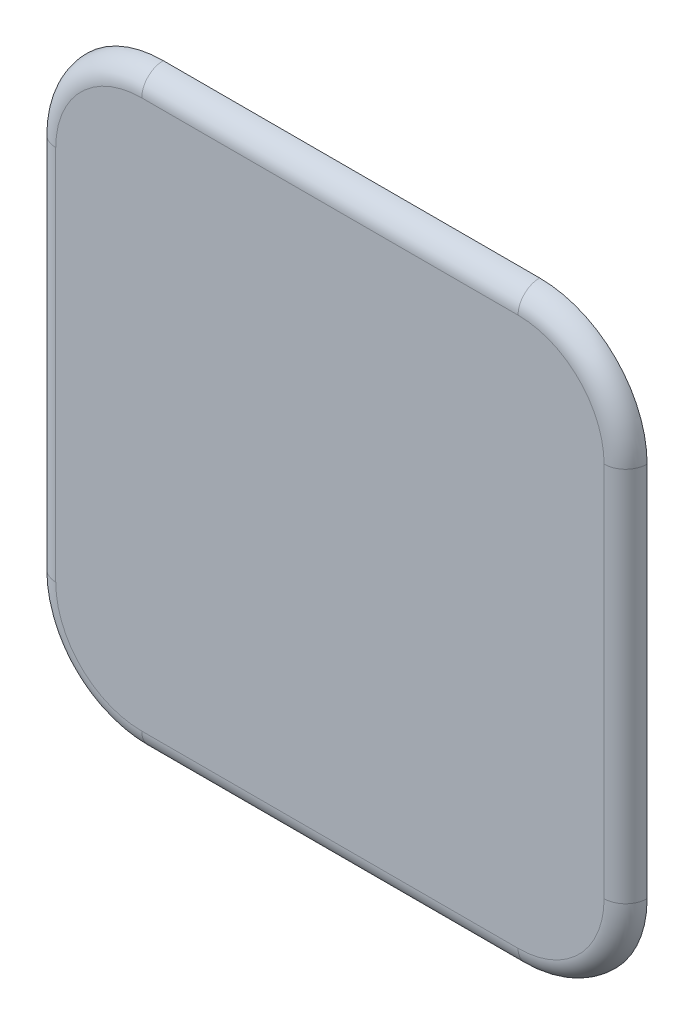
SolidWorks part; units mm, degrees
ref_plane "Front Plane" through (0, 0, 0) normal (0, 0, 1) x (1, 0, 0)
ref_plane "Top Plane" through (0, 0, 0) normal (0, 1, 0) x (1, 0, 0)
ref_plane "Right Plane" through (0, 0, 0) normal (1, 0, 0) x (0, 0, -1)
sketch "Sketch1" plane through (0, 0, 0) normal (0, 0, 1) x (1, 0, 0)
  line L1 (8.75, -13.75) -> (-8.75, -13.75)
  line L2 (13.75, -8.75) -> (13.75, 8.75)
  line L3 (8.75, 13.75) -> (-8.75, 13.75)
  line L4 (-13.75, -8.75) -> (-13.75, 8.75)
  line L5 (13.75, -13.75) -> (-13.75, 13.75) construction
  line L6 (13.75, 13.75) -> (-13.75, -13.75) construction
  arc A0 (-8.75, -13.75) -> (-13.75, -8.75) centre (-8.75, -8.75) cw
  arc A1 (8.75, -13.75) -> (13.75, -8.75) centre (8.75, -8.75) ccw
  arc A2 (13.75, 8.75) -> (8.75, 13.75) centre (8.75, 8.75) ccw
  arc A3 (-8.75, 13.75) -> (-13.75, 8.75) centre (-8.75, 8.75) ccw
  point P0 (0, 0)
  dimension "D2" = 5
  dimension "D1" = 27.5
extrude "Boss-Extrude1" add sketch "Sketch1" along normal blind 1
fillet "Fillet1" radius 1 8 edges at (0, 13.75, 1) (13.75, 0, 1) (0, -13.75, 1) (-13.75, 0, 1) (-12.2855, 12.2855, 1) (12.2855, 12.2855, 1) (12.2855, -12.2855, 1) (-12.2855, -12.2855, 1)
sketch "Sketch2" plane through (0, 0, 0) normal (0, 0, 1) x (1, 0, 0)
  line L6 (0, -13.75) -> (0, 13.75) construction
  line L7 (-8.75, -13.75) -> (8.75, -13.75) construction
  line L8 (8.75, 13.75) -> (-8.75, 13.75) construction
  line L10 (-13.75, 8.75) -> (-13.75, -8.75) construction
  line L11 (-13.75, 0) -> (13.75, 0) construction
  line L12 (13.75, -8.75) -> (13.75, 8.75) construction
